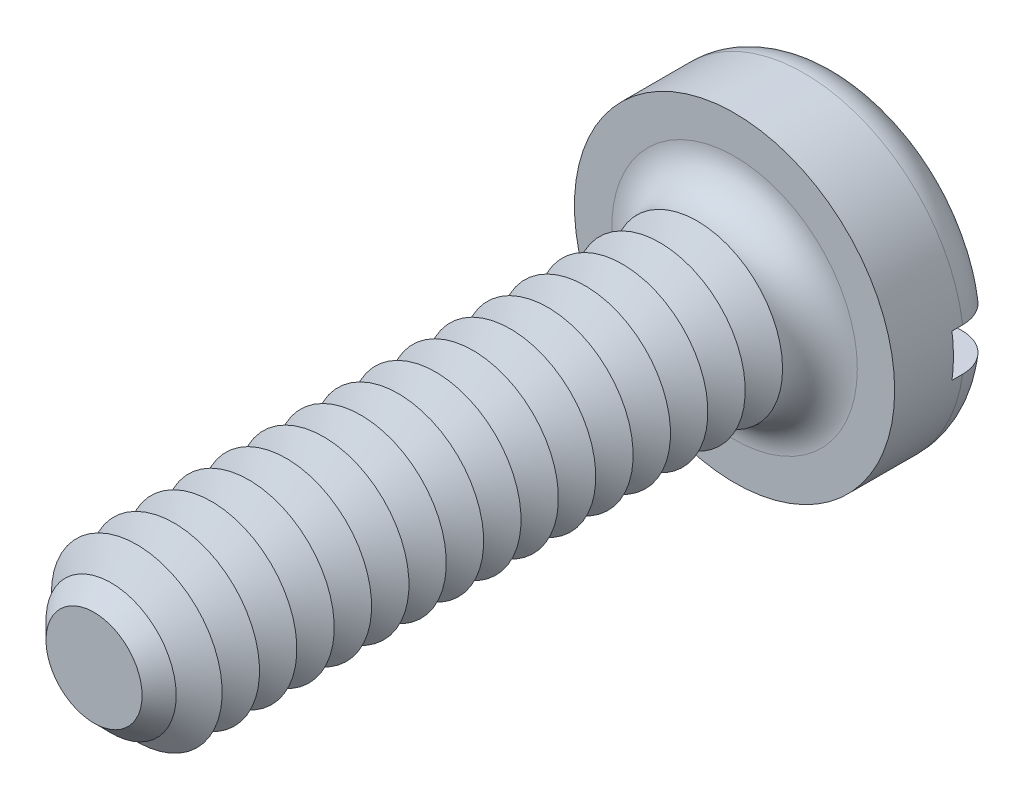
SolidWorks part; units mm, degrees
ref_plane "Front Plane" through (0, 0, 0) normal (0, 0, 1) x (1, 0, 0)
ref_plane "Top Plane" through (0, 0, 0) normal (0, 1, 0) x (1, 0, 0)
ref_plane "Right Plane" through (0, 0, 0) normal (1, 0, 0) x (0, 0, -1)
sketch "Sketch3" plane through (0, 0, 0) normal (0, 0, 1) x (1, 0, 0)
  circle A0 centre (0, 0) radius 1.5
  dimension "D1" = 3
extrude "Boss-Extrude2" add sketch "Sketch3" against normal blind 1
sketch "Sketch4" plane through (0, 0, 0) normal (0, 0, 1) x (1, 0, 0)
  circle A0 centre (0, 0) radius 0.8
  dimension "D1" = 1.6
extrude "Boss-Extrude3" add sketch "Sketch4" along normal blind 6
fillet "Fillet1" radius 0.35 2 edges at (1.5, 0, -1) (0.8, 0, 0)
chamfer "Chamfer1" distance 0.35 angle 45 1 edges at (0.8, 0, 6)
sketch "Sketch5" plane through (0, 0, 0) normal (1, 0, 0) x (0, 0, -1)
  line L0 (1.6944, 0) -> (-7.6738, 0) construction
sketch "Sketch6" plane through (0, 0, 0) normal (1, 0, 0) x (0, 0, -1)
  line L0 (-0.35, 0.8) -> (-0.525, 0.4969)
  line L1 (-0.525, 0.4969) -> (-0.7, 0.8)
  line L2 (-0.35, 0.8) -> (-5.65, 0.8) construction
  line L3 (-0.7, 0.8) -> (-0.35, 0.8)
  dimension "D1" = 0.35
revolve "Cut-Revolve1" cut sketch "Sketch6" angle 360 about L0
pattern_linear "LPattern1" count 16 spacing 0.35 along (0, 0, 1) of "Cut-Revolve1"
sketch "Sketch8" plane through (0, 0, -1) normal (0, 0, -1) x (-1, 0, 0)
  line L1 (1.5, -0.2) -> (-1.5, -0.2)
  line L2 (1.5, -0.2) -> (1.5, 0.2)
  line L3 (1.5, 0.2) -> (-1.5, 0.2)
  line L4 (-1.5, -0.2) -> (-1.5, 0.2)
  line L5 (1.5, -0.2) -> (-1.5, 0.2) construction
  line L6 (1.5, 0.2) -> (-1.5, -0.2) construction
  point P0 (0, 0)
  dimension "D1" = 3
  dimension "D2" = 0.4
extrude "Cut-Extrude1" cut sketch "Sketch8" against normal blind 0.45
